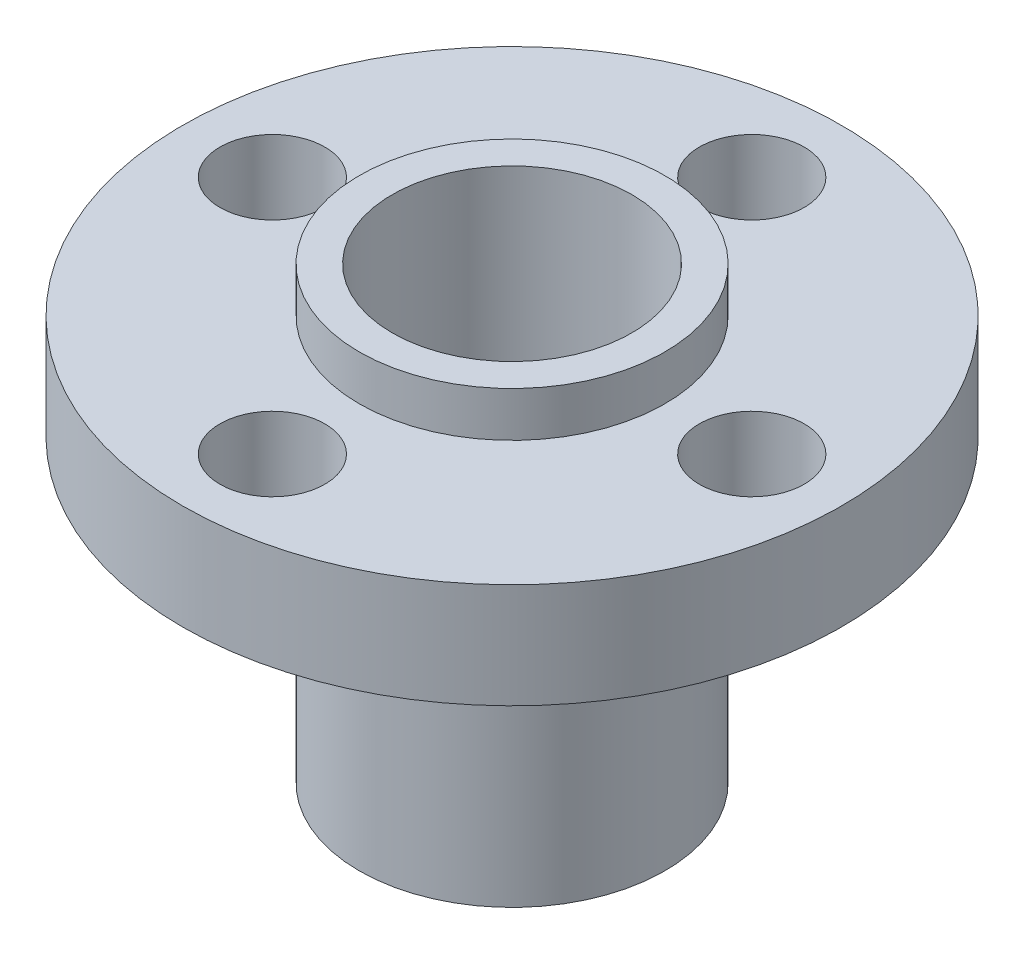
SolidWorks part; units mm, degrees
ref_plane "Alzado" through (0, 0, 0) normal (0, 0, 1) x (1, 0, 0)
ref_plane "Planta" through (0, 0, 0) normal (0, 1, 0) x (1, 0, 0)
ref_plane "Vista lateral" through (0, 0, 0) normal (1, 0, 0) x (0, 0, -1)
sketch "Croquis1" plane through (0, 0, 0) normal (0, 1, 0) x (1, 0, 0)
  circle A0 centre (0, 0) radius 11
  dimension "D1" = 22
extrude "Saliente-Extruir1" add sketch "Croquis1" along normal blind 3.5
sketch "Croquis2" plane through (0, 3.5, 0) normal (0, 1, 0) x (1, 0, 0)
  circle A0 centre (0, 0) radius 5.1
  dimension "D1" = 10.2
extrude "Saliente-Extruir2" add sketch "Croquis2" along normal blind 1.5 and the other way blind 13.5
sketch "Croquis3" plane through (0, 5, 0) normal (0, 1, 0) x (1, 0, 0)
  circle A0 centre (0, 0) radius 4
  dimension "D1" = 8
extrude "Cortar-Extruir1" cut sketch "Croquis3" against normal blind 61.5
sketch "Croquis4" plane through (0, 3.5, 0) normal (0, 1, 0) x (1, 0, 0)
  circle A0 centre (0, 0) radius 8 construction
  circle A1 centre (-8, 0) radius 1.75
  circle A2 centre (0, 8) radius 1.75
  circle A3 centre (8, 0) radius 1.75
  circle A4 centre (0, -8) radius 1.75
  point P5 (0, 0)
  point P6 (0, 0)
  point P7 (0, 0)
  point P14 (0, 0)
  point P15 (0, 0)
  point P16 (0, 0)
  dimension "D1" = 16
  dimension "D2" = 3.5
  dimension "D4" = 8
  dimension "D3" = 4
extrude "Cortar-Extruir2" cut sketch "Croquis4" against normal blind 61.5
